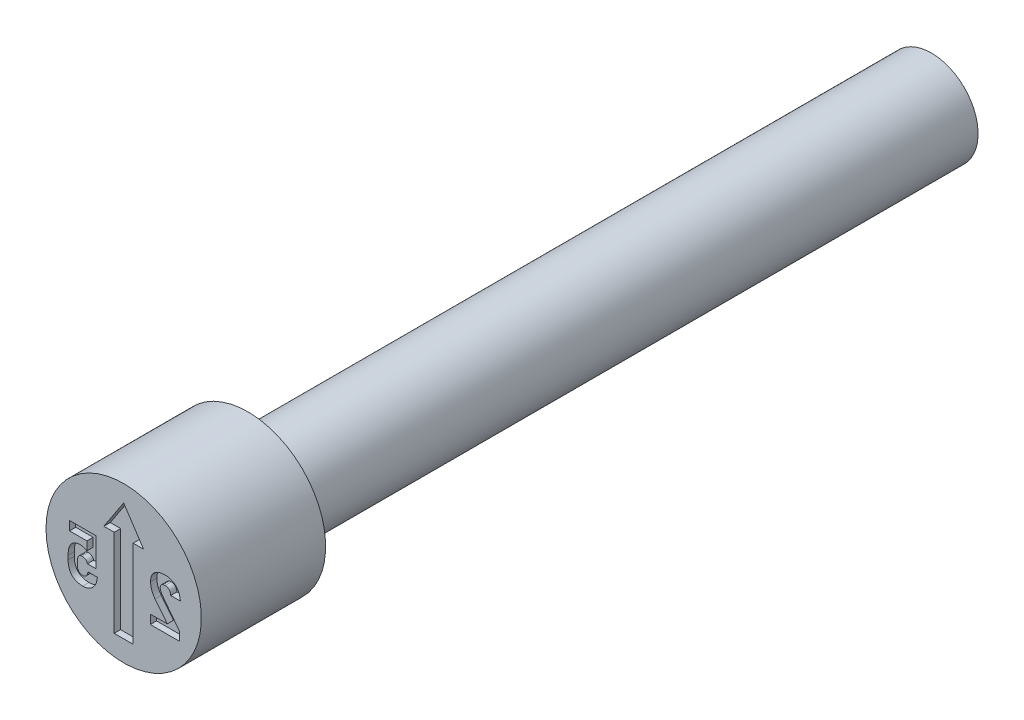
SolidWorks part; units mm, degrees
ref_plane "Front Plane" through (0, 0, 0) normal (0, 0, 1) x (1, 0, 0)
ref_plane "Top Plane" through (0, 0, 0) normal (0, 1, 0) x (1, 0, 0)
ref_plane "Right Plane" through (0, 0, 0) normal (1, 0, 0) x (0, 0, -1)
imported_body "Imported1"
sketch "Sketch1" plane through (0, 0, -0.2134) normal (0, 0, 1) x (1, 0, 0)
  line L7 (0.3192, 0.4953) -> (0, 0.9799)
  line L8 (0, 0.9799) -> (-0.3192, 0.4953)
  line L9 (-0.3192, 0.4953) -> (-0.1524, 0.4953)
  line L10 (-0.1524, 0.4953) -> (-0.1524, -0.9144)
  line L11 (-0.1524, -0.9144) -> (0.1524, -0.9144)
  line L12 (0.1524, -0.9144) -> (0.1524, 0.4953)
  line L13 (0.1524, 0.4953) -> (0.3192, 0.4953)
  line L14 (0.3192, 0.4953) -> (0, 0.9799)
  line L15 (0, 0.9799) -> (-0.3192, 0.4953)
  line L16 (-0.3192, 0.4953) -> (-0.1524, 0.4953)
  line L17 (-0.1524, 0.4953) -> (-0.1524, -0.9144)
  line L18 (-0.1524, -0.9144) -> (0.1524, -0.9144)
  line L19 (0.1524, -0.9144) -> (0.1524, 0.4953)
  line L20 (0.1524, 0.4953) -> (0.3192, 0.4953)
  dimension "D1" = 0
extrude "Boss-Extrude1" add sketch "Sketch1" along normal blind 0.11
sketch "Sketch2" plane through (0, 0, 0) normal (0, 0, 1) x (1, 0, 0)
  text T0 "2   5" font "Bahnschrift" height 0.8
  dimension "D2" = 0.5
extrude "Cut-Extrude1" cut sketch "Sketch2" against normal blind 0.1
